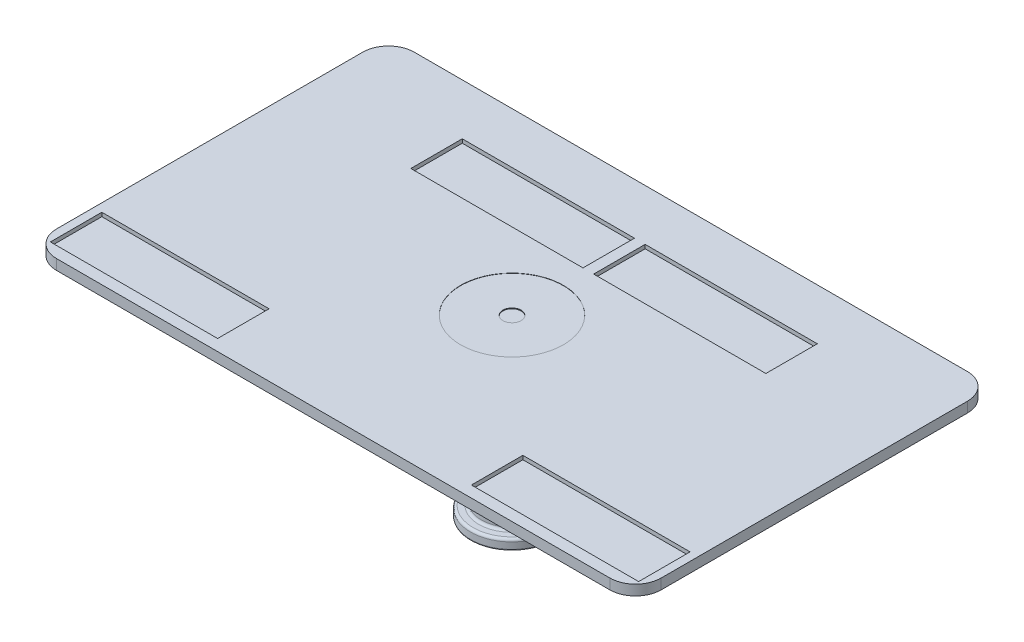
SolidWorks part; units mm, degrees
ref_plane "Front Plane" through (0, 0, 0) normal (0, 0, 1) x (1, 0, 0)
ref_plane "Top Plane" through (0, 0, 0) normal (0, 1, 0) x (1, 0, 0)
ref_plane "Right Plane" through (0, 0, 0) normal (1, 0, 0) x (0, 0, -1)
sketch "Sketch1" plane through (0, 0, 0) normal (0, 1, 0) x (1, 0, 0)
  line L0 (0.8539, 6.95) -> (0.8539, -6.95) construction
  line L1 (12.6039, 6.95) -> (-10.8961, 6.95)
  line L2 (12.6039, 6.95) -> (12.6039, -6.95)
  line L3 (12.6039, -6.95) -> (-10.8961, -6.95)
  line L4 (-10.8961, 6.95) -> (-10.8961, -6.95)
  line L5 (5.7856, -4.5096) -> (12.2856, -4.5096)
  line L6 (7.7539, 2.9669) -> (-6.0461, 2.9669)
  line L7 (0.8539, 2.9669) -> (0.8539, 4.9669)
  line L8 (7.7539, 4.9669) -> (-6.0461, 4.9669)
  line L9 (-6.0461, 2.9669) -> (-6.0461, 4.9669)
  line L10 (0.8539, 2.9669) -> (-6.0461, 4.9669) construction
  line L11 (0.8539, 4.9669) -> (-6.0461, 2.9669) construction
  line L12 (-4.0778, -6.5096) -> (-10.5778, -6.5096)
  line L13 (-4.0778, -6.5096) -> (-4.0778, -4.5096)
  line L14 (-4.0778, -4.5096) -> (-10.5778, -4.5096)
  line L15 (-10.5778, -6.5096) -> (-10.5778, -4.5096)
  line L16 (-4.0778, -6.5096) -> (-10.5778, -4.5096) construction
  line L17 (-4.0778, -4.5096) -> (-10.5778, -6.5096) construction
  line L18 (12.2856, -6.5096) -> (12.2856, -4.5096)
  line L19 (5.7856, -6.5096) -> (12.2856, -6.5096)
  line L20 (5.7856, -6.5096) -> (5.7856, -4.5096)
  line L21 (7.7539, 2.9669) -> (7.7539, 4.9669)
  circle A0 centre (0.8539, 0) radius 2
  point P0 (0, 0)
  point P10 (-2.5961, 3.9669)
  point P15 (-7.3278, -5.5096)
  dimension "D3" = 4
  dimension "D1" = 23.5
  dimension "D2" = 13.9
  dimension "D4" = 2
  dimension "D5" = 6.9
  dimension "D6" = 2
  dimension "D7" = 6.5
extrude "Boss-Extrude3" add sketch "Sketch1" along normal blind 0.4 contours L1 L4 L3 L2 A0 L21 L6 L9 L8 L12 L15 L14 L13 L19 L20 L5 L18
sketch "Sketch4" plane through (0, 0, 0) normal (0, 1, 0) x (1, 0, 0)
  line L0 (0.8539, 6.95) -> (0.8539, -6.95) construction
  line L1 (12.6039, 6.95) -> (-10.8961, 6.95)
  line L2 (12.6039, 6.95) -> (12.6039, -6.95)
  line L3 (12.6039, -6.95) -> (-10.8961, -6.95)
  line L4 (-10.8961, 6.95) -> (-10.8961, -6.95)
  line L5 (5.7856, -4.5096) -> (12.2856, -4.5096)
  line L6 (7.7539, 2.9669) -> (-6.0461, 2.9669)
  line L7 (0.8539, 2.9669) -> (0.8539, 4.9669)
  line L8 (7.7539, 4.9669) -> (-6.0461, 4.9669)
  line L9 (-6.0461, 2.9669) -> (-6.0461, 4.9669)
  line L10 (0.8539, 2.9669) -> (-6.0461, 4.9669) construction
  line L11 (0.8539, 4.9669) -> (-6.0461, 2.9669) construction
  line L12 (-4.0778, -6.5096) -> (-10.5778, -6.5096)
  line L13 (-4.0778, -6.5096) -> (-4.0778, -4.5096)
  line L14 (-4.0778, -4.5096) -> (-10.5778, -4.5096)
  line L15 (-10.5778, -6.5096) -> (-10.5778, -4.5096)
  line L16 (-4.0778, -6.5096) -> (-10.5778, -4.5096) construction
  line L17 (-4.0778, -4.5096) -> (-10.5778, -6.5096) construction
  line L18 (12.2856, -6.5096) -> (12.2856, -4.5096)
  line L19 (5.7856, -6.5096) -> (12.2856, -6.5096)
  line L20 (5.7856, -6.5096) -> (5.7856, -4.5096)
  line L21 (7.7539, 2.9669) -> (7.7539, 4.9669)
  circle A0 centre (0.8539, 0) radius 2
  circle A1 centre (0.8539, 0) radius 0.3541
  point P0 (0, 0)
  point P10 (-2.5961, 3.9669)
  point P15 (-7.3278, -5.5096)
  dimension "D3" = 4
  dimension "D1" = 23.5
  dimension "D2" = 13.9
  dimension "D4" = 2
  dimension "D5" = 6.9
  dimension "D6" = 2
  dimension "D7" = 6.5
extrude "Boss-Extrude5" add sketch "Sketch4" along normal blind 0.39 contours A0 A1
sketch "Sketch5" plane through (0, 0, 0) normal (0, 1, 0) x (1, 0, 0)
  line L0 (0.8539, 6.95) -> (0.8539, -6.95) construction
  line L1 (12.6039, 6.95) -> (-10.8961, 6.95)
  line L2 (12.6039, 6.95) -> (12.6039, -6.95)
  line L3 (12.6039, -6.95) -> (-10.8961, -6.95)
  line L4 (-10.8961, 6.95) -> (-10.8961, -6.95)
  line L5 (5.7856, -4.5096) -> (12.2856, -4.5096)
  line L6 (7.7539, 2.9669) -> (-6.0461, 2.9669)
  line L7 (0.8539, 2.9669) -> (0.8539, 4.9669)
  line L8 (7.7539, 4.9669) -> (-6.0461, 4.9669)
  line L9 (-6.0461, 2.9669) -> (-6.0461, 4.9669)
  line L10 (0.8539, 2.9669) -> (-6.0461, 4.9669) construction
  line L11 (0.8539, 4.9669) -> (-6.0461, 2.9669) construction
  line L12 (-4.0778, -6.5096) -> (-10.5778, -6.5096)
  line L13 (-4.0778, -6.5096) -> (-4.0778, -4.5096)
  line L14 (-4.0778, -4.5096) -> (-10.5778, -4.5096)
  line L15 (-10.5778, -6.5096) -> (-10.5778, -4.5096)
  line L16 (-4.0778, -6.5096) -> (-10.5778, -4.5096) construction
  line L17 (-4.0778, -4.5096) -> (-10.5778, -6.5096) construction
  line L18 (12.2856, -6.5096) -> (12.2856, -4.5096)
  line L19 (5.7856, -6.5096) -> (12.2856, -6.5096)
  line L20 (5.7856, -6.5096) -> (5.7856, -4.5096)
  line L21 (7.7539, 2.9669) -> (7.7539, 4.9669)
  circle A0 centre (0.8539, 0) radius 2
  point P0 (0, 0)
  point P10 (-2.5961, 3.9669)
  point P15 (-7.3278, -5.5096)
  dimension "D3" = 4
  dimension "D1" = 23.5
  dimension "D2" = 13.9
  dimension "D4" = 2
  dimension "D5" = 6.9
  dimension "D6" = 2
  dimension "D7" = 6.5
extrude "Boss-Extrude6" add sketch "Sketch5" along normal blind 0.36 contours A0
sketch "Sketch6" plane through (0, 0, 0) normal (0, 1, 0) x (1, 0, 0)
  line L6 (0.6462, 4.9669) -> (1.0615, 4.9669)
  line L7 (7.7539, 2.9669) -> (-6.0461, 2.9669) construction
  line L8 (7.7539, 4.9669) -> (-6.0461, 4.9669) construction
  line L9 (0.6462, 2.9669) -> (0.6462, 4.9669)
  line L10 (1.0615, 2.9669) -> (1.0615, 4.9669)
  line L11 (0.6462, 2.9669) -> (1.0615, 2.9669)
extrude "Boss-Extrude7" add sketch "Sketch6" along normal blind 0.4
sketch "Sketch7" plane through (0, 0, 0) normal (0, 1, 0) x (1, 0, 0)
  line L0 (-6.0461, 4.9669) -> (0.6462, 4.9669)
  line L1 (0.6462, 4.9669) -> (0.6462, 2.9669)
  line L2 (0.6462, 2.9669) -> (-6.0461, 2.9669)
  line L3 (-6.0461, 2.9669) -> (-6.0461, 4.9669)
  line L4 (1.0615, 4.9669) -> (7.7539, 4.9669)
  line L5 (7.7539, 4.9669) -> (7.7539, 2.9669)
  line L6 (7.7539, 2.9669) -> (1.0615, 2.9669)
  line L7 (1.0615, 2.9669) -> (1.0615, 4.9669)
  line L8 (-10.5778, -4.5096) -> (-4.0778, -4.5096)
  line L9 (-4.0778, -4.5096) -> (-4.0778, -6.5096)
  line L10 (-4.0778, -6.5096) -> (-10.5778, -6.5096)
  line L11 (-10.5778, -6.5096) -> (-10.5778, -4.5096)
  line L12 (5.7856, -4.5096) -> (12.2856, -4.5096)
  line L13 (12.2856, -4.5096) -> (12.2856, -6.5096)
  line L14 (12.2856, -6.5096) -> (5.7856, -6.5096)
  line L15 (5.7856, -6.5096) -> (5.7856, -4.5096)
extrude "Boss-Extrude8" add sketch "Sketch7" along normal blind 0.25
sketch "Sketch8" plane through (0, 0, 0) normal (0, -1, 0) x (1, 0, 0)
  circle A0 centre (0.8539, 0) radius 1.1926
extrude "Boss-Extrude9" add sketch "Sketch8" along normal blind 6
sketch "Sketch9" plane through (0, -6, 0) normal (0, -1, 0) x (1, 0, 0)
  circle A0 centre (0.8539, 0) radius 1.6097
extrude "Boss-Extrude10" add sketch "Sketch9" along normal blind 0.4
fillet "Fillet2" radius 0.1 2 edges at (0.8539, -6, -1.6097) (0.8539, -6, -1.1926)
fillet "Fillet3" radius 0.05 1 edges at (0.8539, -6.4, -1.6097)
fillet "Fillet4" radius 1 4 edges at (-10.8961, 0.2, 6.95) (-10.8961, 0.2, -6.95) (12.6039, 0.2, -6.95) (12.6039, 0.2, 6.95)
equation "\"10mmm\"=0.05"
